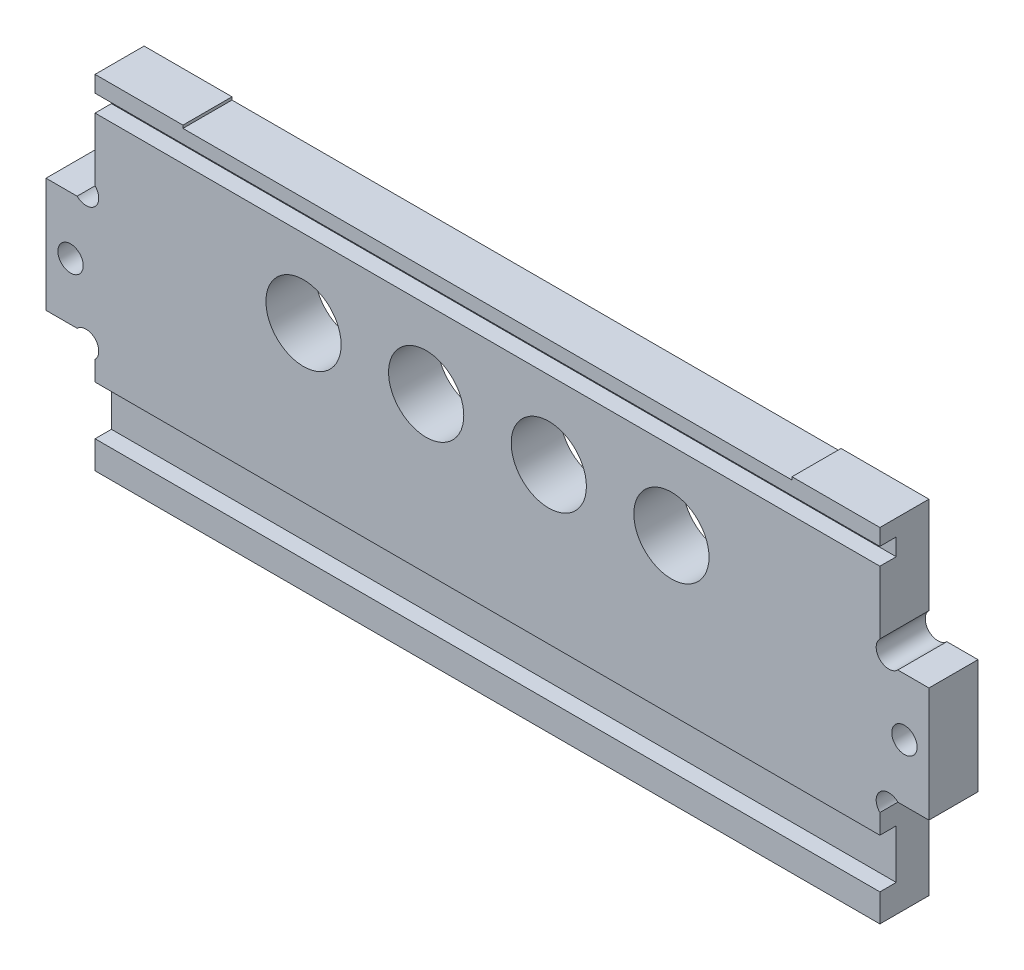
SolidWorks part; units mm, degrees
ref_plane "Plan de face" through (0, 0, 0) normal (0, 0, 1) x (1, 0, 0)
ref_plane "Plan de dessus" through (0, 0, 0) normal (0, 1, 0) x (1, 0, 0)
ref_plane "Plan de droite" through (0, 0, 0) normal (1, 0, 0) x (0, 0, -1)
sketch "Esquisse1" plane through (0, 0, 0) normal (0, 0, 1) x (1, 0, 0)
  line L0 (-18.4854, 0) -> (174.0371, 0) construction
  line L1 (0, -14.575) -> (0, 70.5052) construction
  line L2 (-18.4854, 42) -> (174.0371, 42) construction
  line L3 (-49.4967, 21) -> (232.5709, 21) construction
  line L4 (6, 65.2215) -> (6, -6.5783) construction
  line L5 (-6.1176, 9.4) -> (153.5283, 9.4) construction
  line L6 (-6.1176, 3.4) -> (153.5309, 3.4) construction
  line L7 (101.5, 56.6286) -> (101.5, -12.2812) construction
  line L8 (-7.2936, 37.9) -> (161.4629, 37.9) construction
  line L9 (-7.2936, 40) -> (161.4629, 40) construction
  line L10 (102, 56.6286) -> (102, -3.0419) construction
  line L11 (108, 70.5052) -> (108, -14.575) construction
  line L12 (54, 61.2759) -> (54, -18.1878) construction
  line L13 (6.2304, 24.4) -> (145.746, 24.4) construction
  line L14 (6, 42) -> (16.75, 42)
  line L15 (6.5, 15.8677) -> (6.5, 70.5052) construction
  line L16 (-5.5754, 14) -> (7.661, 14) construction
  line L17 (6, 0) -> (102, 0)
  line L18 (6, 28) -> (-0.5822, 34.5822) construction
  line L19 (31.5, 30.0552) -> (31.5, 18.1829) construction
  line L20 (16.4844, 28.4) -> (139.4014, 28.4) construction
  line L21 (6, 42) -> (6, 30.192)
  line L22 (3.808, 28) -> (0, 28)
  line L23 (0, 28) -> (0, 14)
  line L24 (0, 14) -> (3.808, 14)
  line L25 (6, 11.808) -> (6, 0)
  line L26 (3, 24.9685) -> (3, 16.3645) construction
  line L27 (102, 11.808) -> (102, 0)
  line L28 (-9.5964, 28) -> (7.661, 28) construction
  line L29 (108, 14) -> (104.192, 14)
  line L30 (108, 28) -> (108, 14)
  line L31 (104.192, 28) -> (108, 28)
  line L32 (102, 42) -> (102, 30.192)
  line L33 (46.5, 30.0552) -> (46.5, 18.1829) construction
  line L34 (61.5, 30.0552) -> (61.5, 18.1829) construction
  line L35 (76.5, 30.0552) -> (76.5, 18.1829) construction
  line L36 (16.75, 48.0248) -> (16.75, 39.1764) construction
  line L37 (91.25, 48.0248) -> (91.25, 39.1764) construction
  line L38 (14.7307, 41.65) -> (111.2637, 41.65) construction
  line L39 (16.75, 42) -> (16.75, 41.65)
  line L40 (91.25, 41.65) -> (91.25, 42)
  line L41 (-7.2936, 6.4) -> (158.0721, 6.4) construction
  line L42 (91.25, 41.65) -> (16.75, 41.65)
  line L43 (91.25, 42) -> (102, 42)
  circle A1 centre (31.5, 28.4) radius 4.6
  circle A2 centre (3, 21) radius 1.55
  arc A3 (3.808, 28) -> (6, 30.192) centre (4.904, 29.096) ccw
  arc A4 (3.808, 14) -> (6, 11.808) centre (4.904, 12.904) cw
  circle A5 centre (105, 21) radius 1.55
  arc A6 (104.192, 14) -> (102, 11.808) centre (103.096, 12.904) ccw
  arc A7 (104.192, 28) -> (102, 30.192) centre (103.096, 29.096) cw
  circle A8 centre (46.5, 28.4) radius 4.6
  circle A9 centre (61.5, 28.4) radius 4.6
  circle A10 centre (76.5, 28.4) radius 4.6
  dimension "D10" = 25
  dimension "D12" = 7
  dimension "D14" = 45
  dimension "D16" = 3
  dimension "D17" = 37.25
  dimension "D6" = 15
  dimension "D11" = 4
  dimension "D2" = 0.5
  dimension "D3" = 95
  dimension "D4" = 0.5
  dimension "D5" = 6
  dimension "D7" = 2
  dimension "D8" = 6
  dimension "D9" = 2.1
  dimension "D13" = 7
  dimension "D15" = 3
  dimension "D18" = 0.35
extrude "Extrusion1" add sketch "Esquisse1" along normal blind 6
sketch "Esquisse2" plane through (0, 0, 6) normal (0, 0, 1) x (1, 0, 0)
  line L0 (-3.4366, 3.4) -> (153.5234, 3.4) construction
  line L1 (-3.4366, 9.4) -> (153.5234, 9.4) construction
  line L2 (-3.4366, 37.9) -> (153.5234, 37.9) construction
  line L3 (-3.4366, 40) -> (153.5234, 40) construction
  line L4 (3, 49.9286) -> (3, -10.6391) construction
  line L5 (145, 46.2854) -> (145, -3.201) construction
  line L6 (0, 45.2228) -> (0, -3.201) construction
  line L7 (148, 45.2228) -> (148, -5.9334) construction
  line L8 (-5.4366, 42) -> (149.5966, 42) construction
  line L9 (149.5966, 0) -> (-3.4366, 0) construction
  line L11 (3, 40) -> (145, 40)
  line L12 (3, 40) -> (3, 37.9)
  line L13 (3, 37.9) -> (145, 37.9)
  line L14 (145, 40) -> (145, 37.9)
  line L15 (3, 9.4) -> (145, 9.4)
  line L16 (3, 9.4) -> (3, 3.4)
  line L17 (3, 3.4) -> (145, 3.4)
  line L18 (145, 9.4) -> (145, 3.4)
  dimension "D1" = 3
  dimension "D2" = 3.4
  dimension "D3" = 6
  dimension "D4" = 2
  dimension "D5" = 2.1
  dimension "D6" = 3
extrude "Enlèv. mat.-Extru.1" cut sketch "Esquisse2" against normal blind 2
